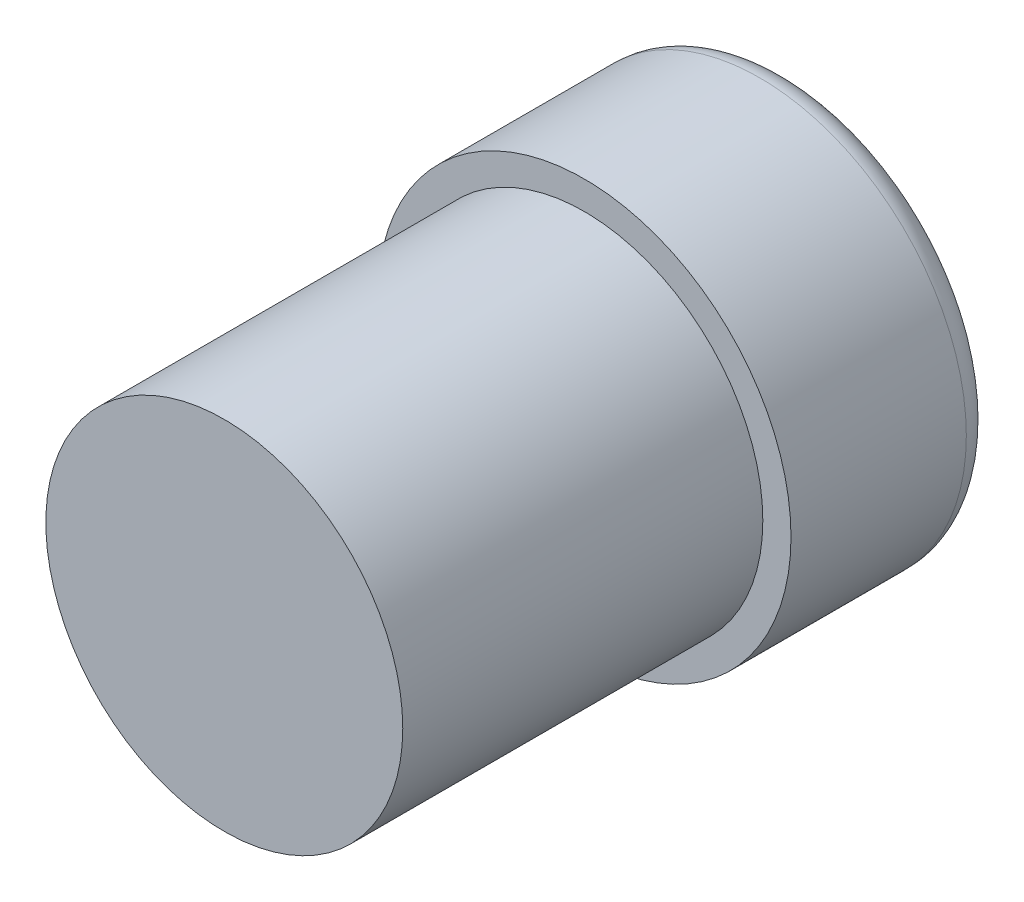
SolidWorks part; units mm, degrees
ref_plane "Front Plane" through (0, 0, 0) normal (0, 0, 1) x (1, 0, 0)
ref_plane "Top Plane" through (0, 0, 0) normal (0, 1, 0) x (1, 0, 0)
ref_plane "Right Plane" through (0, 0, 0) normal (1, 0, 0) x (0, 0, -1)
sketch "Sketch1" plane through (0, 0, 0) normal (1, 0, 0) x (0, 0, -1)
  line L0 (-15, 0) -> (15, 0)
  line L1 (15, 0) -> (15, 9.5)
  line L2 (13.5, 11) -> (4.1667, 11)
  line L3 (4.1667, 11) -> (4.1667, 9.5)
  line L4 (4.1667, 9.5) -> (-15, 9.5)
  line L5 (-15, 0) -> (-15, 9.5)
  arc A0 (15, 9.5) -> (13.5, 11) centre (13.5, 9.5) ccw
  point P4 (0, 0)
  point P11 (15, 11)
  dimension "D4" = 1.5
  dimension "D1" = 30
  dimension "D2" = 11
  dimension "D3" = 9.5
revolve "Revolve1" add sketch "Sketch1" angle 360 about L0
